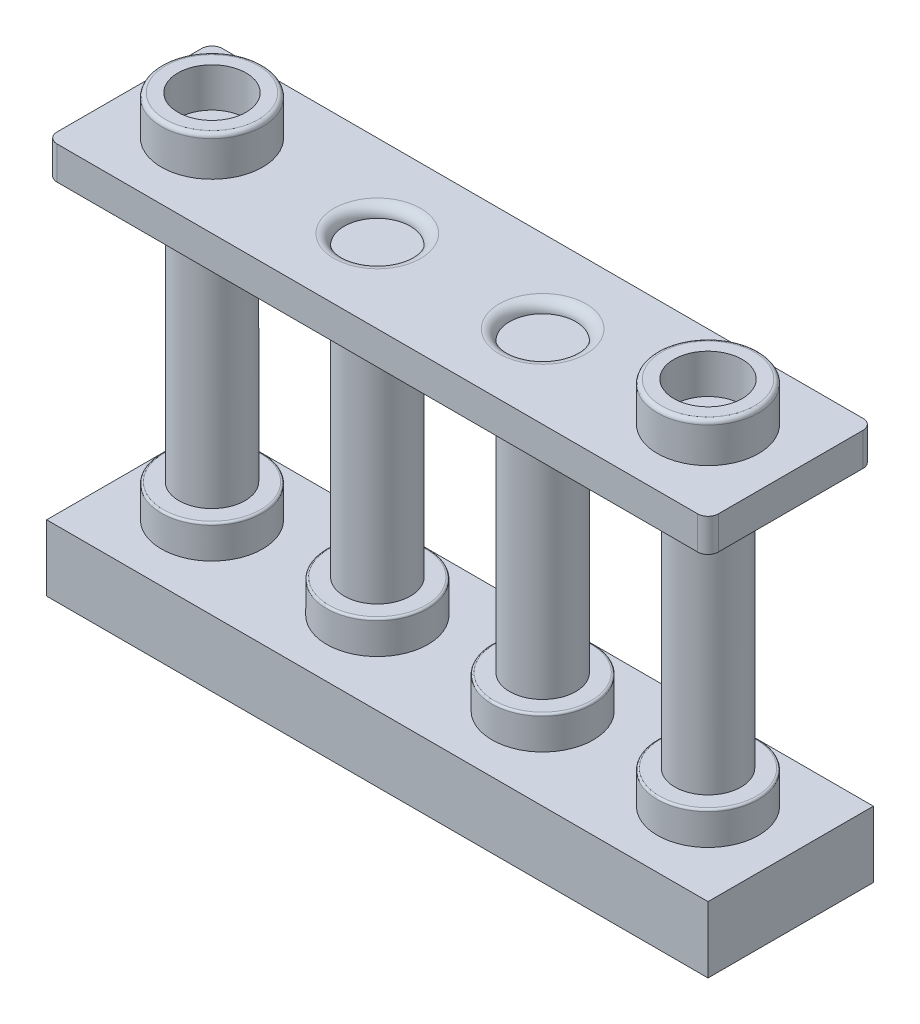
SolidWorks part; units mm, degrees
ref_plane "Vorne" through (0, 0, 0) normal (0, 0, 1) x (1, 0, 0)
ref_plane "Oben" through (0, 0, 0) normal (0, 1, 0) x (1, 0, 0)
ref_plane "Rechts" through (0, 0, 0) normal (1, 0, 0) x (0, 0, -1)
sketch "Skizze1" plane through (0, 0, 0) normal (0, 0, 1) x (1, 0, 0)
  line L1 (0, 0) -> (32, 0)
  line L2 (0, 0) -> (0, 19.2)
  line L3 (0, 19.2) -> (32, 19.2)
  line L4 (32, 0) -> (32, 19.2)
  dimension "D1" = 19.2
  dimension "D2" = 32
extrude "Linear austragen1" add sketch "Skizze1" along normal blind 8
sketch "Skizze2" plane through (0, 0, 8) normal (0, 0, 1) x (1, 0, 0)
  line L0 (0, 19.2) -> (0, 0) construction
  line L1 (0, 17.6) -> (32, 17.6)
  line L2 (0, 17.6) -> (0, 3.2)
  line L3 (0, 3.2) -> (32, 3.2)
  line L4 (32, 17.6) -> (32, 3.2)
  line L5 (32, 0) -> (32, 19.2) construction
  line L6 (32, 19.2) -> (0, 19.2) construction
  line L7 (0, 0) -> (32, 0) construction
  dimension "D1" = 1.6
  dimension "D2" = 3.2
extrude "Schnitt-Linear austragen1" cut sketch "Skizze2" against normal blind 8
fillet "Verrundung1" radius 0.5 1 edges at (0, 18.4, 8)
fillet "Verrundung2" radius 0.5 3 edges at (32, 18.4, 0) (32, 18.4, 8) (0, 18.4, 0)
sketch "Skizze3" plane through (0, 3.2, 0) normal (0, 1, 0) x (-1, 0, 0)
  line L0 (-32, 0) -> (-32, 8) construction
  line L1 (0, 0) -> (0, 8) construction
  line L2 (0, 8) -> (-32, 8) construction
  line L3 (-31.5, 8) -> (-0.5, 8) construction
  circle A0 centre (-28, 4) radius 1.6
  circle A1 centre (-20, 4) radius 1.6
  circle A2 centre (-12, 4) radius 1.6
  circle A3 centre (-4, 4) radius 1.6
  dimension "D1" = 3.2
  dimension "D2" = 3.2
  dimension "D3" = 3.2
  dimension "D4" = 3.2
  dimension "D5" = 4
  dimension "D6" = 4
  dimension "D7" = 8
  dimension "D8" = 8
  dimension "D9" = 4
  dimension "D10" = 4
  dimension "D11" = 4
  dimension "D12" = 4
extrude "Linear austragen2" add sketch "Skizze3" along normal up to next
sketch "Skizze4" plane through (0, 3.2, 0) normal (0, 1, 0) x (-1, 0, 0)
  circle A4 centre (-28, 4) radius 2.45
  circle A5 centre (-20, 4) radius 2.45
  circle A6 centre (-12, 4) radius 2.45
  circle A7 centre (-4, 4) radius 2.45
extrude "Linear austragen3" add sketch "Skizze4" along normal blind 1.6
fillet "Verrundung4" radius 0.1 4 edges at (25.55, 4.8, 4) (17.55, 4.8, 4) (9.55, 4.8, 4) (1.55, 4.8, 4)
sketch "Skizze6" plane through (0, 19.2, 0) normal (0, 1, 0) x (-1, 0, 0)
  line L0 (-30.35, 4) -> (-1.65, 4) construction
  line L1 (-27.7, 1.6692) -> (-27.7, 6.3308) construction
  line L2 (-19.9, 1.6521) -> (-19.9, 6.3479) construction
  line L3 (-11.7, 1.6692) -> (-11.7, 6.4316) construction
  line L4 (-3.9, 1.6521) -> (-3.9, 6.3479) construction
  circle A0 centre (-28, 4) radius 2.35 construction
  circle A1 centre (-4, 4) radius 2.35 construction
  circle A2 centre (-20, 4) radius 2.35 construction
  circle A3 centre (-12, 4) radius 2.35 construction
  circle A4 centre (-12, 4) radius 2.45 construction
  circle A5 centre (-28, 4) radius 2.45
  circle A8 centre (-4, 4) radius 2.45
  dimension "D1" = 4.9
  dimension "D2" = 4.9
extrude "Linear austragen4" add sketch "Skizze6" along normal blind 1.9
fillet "Verrundung6" radius 0.2 2 edges at (28, 21.1, 6.45) (4, 21.1, 6.45)
sketch "Skizze7" plane through (0, 21.1, 0) normal (0, 1, 0) x (-1, 0, 0)
  circle A0 centre (-28, 4) radius 1.65
  circle A1 centre (-4, 4) radius 1.65
  dimension "D1" = 3.3
  dimension "D2" = 3.3
extrude "Schnitt-Linear austragen2" cut sketch "Skizze7" against normal blind 1.9
sketch "Skizze8" plane through (0, 0, 0) normal (0, -1, 0) x (1, 0, 0)
  line L0 (32, 8) -> (32, 0) construction
  line L1 (30.4, 6.4) -> (1.6, 6.4)
  line L2 (30.4, 6.4) -> (30.4, 1.6)
  line L3 (30.4, 1.6) -> (1.6, 1.6)
  line L4 (1.6, 6.4) -> (1.6, 1.6)
  line L5 (0, 8) -> (0, 0) construction
  line L6 (0, 0) -> (32, 0) construction
  line L7 (0, 8) -> (32, 8) construction
  dimension "D1" = 1.6
  dimension "D2" = 1.6
  dimension "D3" = 1.6
  dimension "D4" = 1.6
extrude "Schnitt-Linear austragen3" cut sketch "Skizze8" against normal blind 2.1
sketch "Skizze9" plane through (0, 2.1, 0) normal (0, -1, 0) x (1, 0, 0)
  circle A0 centre (4, 4) radius 1.3
  circle A1 centre (12, 4) radius 1.3
  circle A2 centre (20, 4) radius 1.3
  circle A3 centre (28, 4) radius 1.3
  dimension "D1" = 2.6
  dimension "D2" = 2.6
  dimension "D3" = 2.6
  dimension "D4" = 2.6
extrude "Schnitt-Linear austragen4" cut sketch "Skizze9" against normal blind 1.8
sketch "Skizze10" plane through (0, 2.1, 0) normal (0, -1, 0) x (1, 0, 0)
  line L0 (2.7, 4) -> (29.3847, 4) construction
  line L1 (0, 8) -> (0, 0) construction
  line L2 (0, 0) -> (32, 0) construction
  line L3 (32, 0) -> (32, 8) construction
  circle A0 centre (4, 4) radius 1.3 construction
  circle A1 centre (8, 4) radius 0.8
  circle A2 centre (8, 4) radius 1.6
  circle A3 centre (16, 4) radius 1.6
  circle A4 centre (16, 4) radius 0.8
  circle A5 centre (24, 4) radius 1.6
  circle A6 centre (24, 4) radius 0.8
  point P15 (32, 4)
  dimension "D4" = 3.2
  dimension "D5" = 1.6
  dimension "D7" = 3.2
  dimension "D8" = 1.6
  dimension "D9" = 3.2
  dimension "D10" = 1.6
  dimension "D1" = 16
  dimension "D2" = 8
  dimension "D3" = 8
  dimension "D6" = 4
extrude "Linear austragen5" add sketch "Skizze10" along normal blind 1.9
sketch "Skizze14" plane through (0, 19.2, 0) normal (0, 1, 0) x (-1, 0, 0)
  line L0 (-31.5, 8) -> (-0.5, 8) construction
  line L1 (-27.7, 5.6225) -> (-27.7, 2.3775) construction
  line L2 (-12, 5.6) -> (-12, 2.4) construction
  line L3 (-32, 7.5) -> (-32, 0.5) construction
  circle A0 centre (-20, 4) radius 1.6
  circle A1 centre (-12, 4) radius 1.6
  circle A2 centre (-28, 4) radius 1.65 construction
  dimension "D3" = 3.2
  dimension "D4" = 3.2
  dimension "D5" = 8
  dimension "D1" = 4
  dimension "D2" = 4
  dimension "D6" = 12
extrude "Schnitt-Linear austragen5" cut sketch "Skizze14" against normal blind 0.5
fillet "Verrundung7" radius 0.5 2 edges at (20, 19.2, 5.6) (12, 19.2, 5.6)
